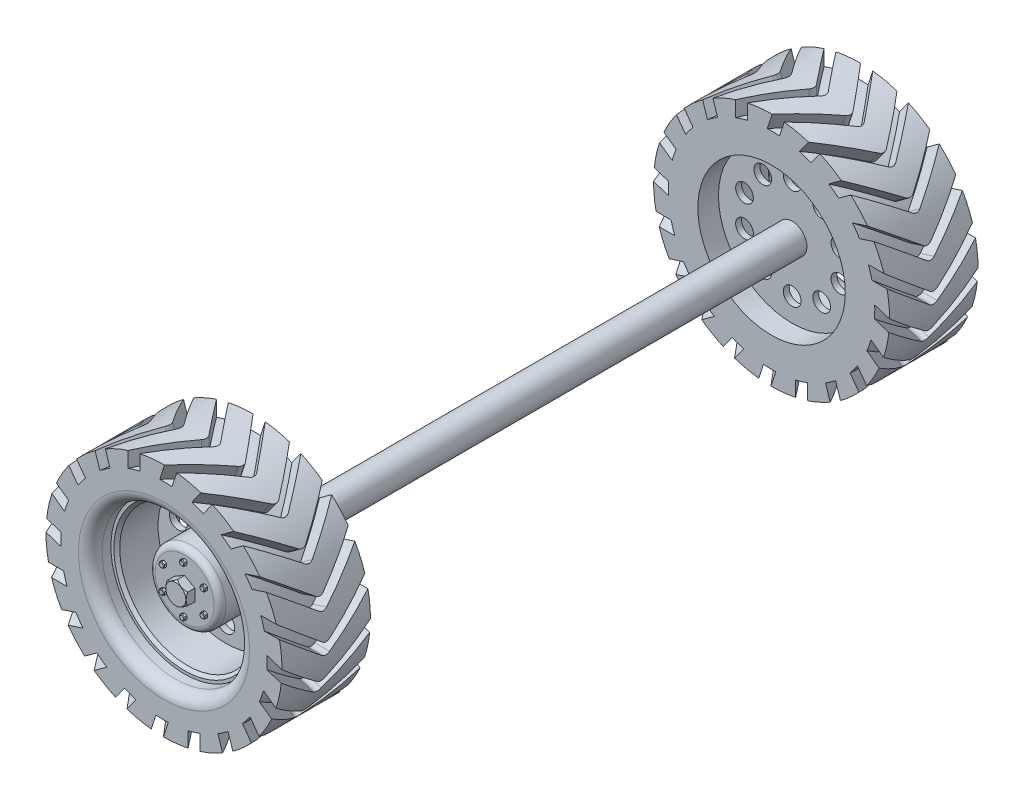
SolidWorks part; units mm, degrees
ref_plane "前基準面" through (0, 0, 0) normal (0, 0, 1) x (1, 0, 0)
ref_plane "上基準面" through (0, 0, 0) normal (0, 1, 0) x (1, 0, 0)
ref_plane "右基準面" through (0, 0, 0) normal (1, 0, 0) x (0, 0, -1)
sketch "草圖1" plane through (0, 0, 0) normal (0, 0, 1) x (1, 0, 0)
  circle A0 centre (0, 0) radius 125
  dimension "D1" = 250
extrude "填料-伸長1" add sketch "草圖1" along normal mid plane 80
shell "薄殼1" thickness 10
sketch "草圖3" plane through (0, 0, 0) normal (0, 0, 1) x (1, 0, 0)
  circle A0 centre (0, 0) radius 200
  circle A1 centre (0, 0) radius 125
  dimension "D1" = 400
  dimension "D2" = 250
extrude "填料-伸長2" add sketch "草圖3" along normal mid plane 150
chamfer "導角1" distance 5 angle 45 1 edges at (115, 0, 40)
fillet "圓角2" radius 20 1 edges at (125, 0, 75)
sketch "草圖4" plane through (0, 0, -30) normal (0, 0, 1) x (1, 0, 0)
  circle A0 centre (0, 0) radius 60
  dimension "D1" = 120
extrude "填料-伸長3" add sketch "草圖4" along normal up to surface (70 mm away)
fillet "圓角4" radius 10 1 edges at (60, 0, 40)
sketch "草圖5" plane through (0, 0, -30) normal (0, 0, 1) x (1, 0, 0)
  line L0 (0, 0) -> (0, 85) construction
  circle A0 centre (0, 85) radius 15
  dimension "D1" = 30
  dimension "D2" = 85
extrude "除料-伸長2" cut sketch "草圖5" against normal blind 100
pattern_circular "環狀複製排列1" count 10 over 360 about axis through (0, 0, 0) along (0, 0, 1) of "除料-伸長2"
fillet "圓角5" radius 5 1 edges at (60, 0, -30)
sketch "草圖7" plane through (0, 0, 40) normal (0, 0, 1) x (1, 0, 0)
  circle A0 centre (0, 0) radius 20
  dimension "D1" = 40
extrude "填料-伸長5" add sketch "草圖7" along normal blind 15
chamfer "導角2" distance 3 angle 45 1 edges at (20, 0, 55)
sketch "草圖8" plane through (0, 0, 55) normal (0, 0, 1) x (1, 0, 0)
  line L1 (0, 20) -> (-17.3205, 10)
  line L2 (-17.3205, 10) -> (-17.3205, -10)
  line L3 (-17.3205, -10) -> (0, -20)
  line L4 (0, -20) -> (17.3205, -10)
  line L5 (17.3205, -10) -> (17.3205, 10)
  line L6 (17.3205, 10) -> (0, 20)
  circle A0 centre (0, 0) radius 17.3205 construction
  circle A1 centre (0, 0) radius 20
extrude "除料-伸長3" cut sketch "草圖8" against normal blind 15 contours L1 A1 | L6 A1 | L2 A1 | L3 A1 | L4 A1 | L5 A1
sketch "草圖9" plane through (0, 0, 40) normal (0, 0, 1) x (1, 0, 0)
  circle A0 centre (0, 0) radius 40 construction
  circle A1 centre (0, 40) radius 5
  dimension "D1" = 80
  dimension "D2" = 10
extrude "填料-伸長6" add sketch "草圖9" along normal blind 5
chamfer "導角3" distance 1.5 angle 45 1 edges at (5, 40, 45)
pattern_circular "環狀複製排列2" count 6 over 360 about axis through (0, 0, 0) along (0, 0, 1) of "填料-伸長6"
chamfer "導角4" distance 1.5 angle 45 5 edges at (37.141, 15.6699, 45) (32.141, -24.3301, 45) (-5, -40, 45) (-37.141, -15.6699, 45) (-32.141, 24.3301, 45)
sketch "草圖10" plane through (0, 0, 45) normal (0, 0, 1) x (1, 0, 0)
  line L1 (0, 45) -> (-4.3301, 42.5)
  line L2 (-4.3301, 42.5) -> (-4.3301, 37.5)
  line L3 (-4.3301, 37.5) -> (0, 35)
  line L4 (0, 35) -> (4.3301, 37.5)
  line L5 (4.3301, 37.5) -> (4.3301, 42.5)
  line L6 (4.3301, 42.5) -> (0, 45)
  circle A0 centre (0, 40) radius 4.3301 construction
  circle A1 centre (0, 40) radius 5
extrude "除料-伸長4" cut sketch "草圖10" against normal blind 5 contours L1 A1 | L6 A1 | L2 A1 | L3 A1 | L4 A1 | L5 A1
pattern_circular "環狀複製排列4" count 6 over 360 about axis through (0, 0, 0) along (0, 0, 1) of "除料-伸長4"
ref_plane "平面1" through (0, 300, 0) normal (0, 1, 0) x (1, 0, 0)
sketch "草圖11" plane through (0, 300, 0) normal (0, 1, 0) x (1, 0, 0)
  line L1 (-5.1172, -6.303) -> (-60.8905, -75)
  line L2 (0, 0) -> (20, 0) construction
  line L8 (-200, -75) -> (200, -75) construction
  line L9 (-5.1172, 6.303) -> (-60.8905, 75)
  line L10 (200, 75) -> (-200, 75) construction
  line L11 (-60.8905, 75) -> (-60.8905, -75) construction
  line L16 (14.8828, -6.303) -> (-40.8905, -75)
  line L17 (14.8828, 6.303) -> (-40.8905, 75)
  line L18 (-60.8905, -75) -> (-40.8905, -75)
  line L19 (-60.8905, 75) -> (-40.8905, 75)
  arc A0 (14.8828, -6.303) -> (14.8828, 6.303) centre (7.1192, 0) ccw
  arc A1 (-5.1172, -6.303) -> (-5.1172, 6.303) centre (-12.8808, 0) ccw
  dimension "D2" = 10
  dimension "D1" = 20
sketch "草圖13" plane through (0, 0, 75) normal (0, 0, 1) x (1, 0, 0)
  circle A0 centre (0, 0) radius 175
  dimension "D1" = 350
surface "曲面-伸長1" sketch "草圖13" parameters "D1"=176
extrude "除料-伸長5" cut sketch "草圖11" against normal up to surface (125.0748 mm away)
pattern_circular "環狀複製排列6" count 20 over 360 about axis through (0, 0, 0) along (0, 0, 1) of "除料-伸長5"
sketch "草圖14" plane through (0, 0, -40) normal (0, 0, -1) x (-1, 0, 0)
  circle A0 centre (0, 0) radius 25
  dimension "D1" = 50
extrude "填料-伸長7" add sketch "草圖14" along normal blind 1000
ref_plane "平面2" through (0, 0, -515) normal (0, 0, -1) x (-1, 0, 0)
mirror "鏡射2" about plane through (0, 0, -515) normal (0, 0, -1) of "環狀複製排列6", "除料-伸長5", "環狀複製排列4", "除料-伸長4", "環狀複製排列2", "填料-伸長6", "除料-伸長3", "填料-伸長5", "環狀複製排列1", "除料-伸長2", "填料-伸長3", "填料-伸長2", "薄殼1", "填料-伸長1"
fillet "圓角7" radius 20 1 edges at (125, 0, -1105)
sketch "草圖15" plane through (0, 0, -1070) normal (0, 0, -1) x (-1, 0, 0)
  circle A0 centre (0, 0) radius 60
  circle A1 centre (0, 0) radius 115
  dimension "D1" = 120
  dimension "D2" = 230
extrude "除料-伸長6" cut sketch "草圖15" against normal up to surface (70 mm away)
chamfer "導角5" distance 5 angle 45 1 edges at (-115, 0, -1070)
fillet "圓角8" radius 10 1 edges at (-60, 0, -1070)
sketch "草圖16" plane through (0, 0, -1070) normal (0, 0, -1) x (-1, 0, 0)
  circle A0 centre (0, 0) radius 20
extrude "填料-伸長8" add sketch "草圖16" along normal up to surface (15 mm away)
sketch "草圖17" plane through (0, 0, -1070) normal (0, 0, -1) x (-1, 0, 0)
  circle A0 centre (0, 40) radius 5
  circle A1 centre (34.641, 20) radius 5
  circle A2 centre (34.641, -20) radius 5
  circle A3 centre (0, -40) radius 5
  circle A4 centre (-34.641, -20) radius 5
  circle A5 centre (-34.641, 20) radius 5
  point P15 (0, 0)
  dimension "D1" = 6
extrude "填料-伸長9" add sketch "草圖17" along normal up to surface (5 mm away)
chamfer "導角6" distance 3 angle 45 1 edges at (-20, 0, -1085)
chamfer "導角7" distance 1.5 angle 45 6 edges at (29.641, -20, -1075) (-5, -40, -1075) (-39.641, -20, -1075) (-39.641, 20, -1075) (29.641, 20, -1075) (-5, 40, -1075)
sketch "草圖19" plane through (0, 0, -1085) normal (0, 0, -1) x (-1, 0, 0)
  line L7 (0, 20) -> (-17.3205, 10)
  line L8 (-17.3205, 10) -> (-17.3205, -10)
  line L9 (-17.3205, -10) -> (0, -20)
  line L10 (0, -20) -> (17.3205, -10)
  line L11 (17.3205, -10) -> (17.3205, 10)
  line L12 (17.3205, 10) -> (0, 20)
  circle A0 centre (0, 0) radius 17.3205 construction
  circle A1 centre (0, 0) radius 20
extrude "除料-伸長7" cut sketch "草圖19" against normal up to surface (15 mm away) contours L12 A1 | L11 A1 | L10 A1 | L9 A1 | L8 A1 | L7 A1
sketch "草圖20" plane through (0, 0, -1075) normal (0, 0, -1) x (-1, 0, 0)
  line L1 (0, 45) -> (-4.3301, 42.5)
  line L2 (-4.3301, 42.5) -> (-4.3301, 37.5)
  line L3 (-4.3301, 37.5) -> (0, 35)
  line L4 (0, 35) -> (4.3301, 37.5)
  line L5 (4.3301, 37.5) -> (4.3301, 42.5)
  line L6 (4.3301, 42.5) -> (0, 45)
  circle A0 centre (0, 40) radius 4.3301 construction
  circle A1 centre (0, 40) radius 5
extrude "除料-伸長8" cut sketch "草圖20" against normal up to surface (5 mm away) contours L6 A1 | L1 A1 | L2 A1 | L3 A1 | L4 A1 | L5 A1
pattern_circular "環狀複製排列7" count 6 over 360 about axis through (0, 0, 0) along (0, 0, 1) of "除料-伸長8"
fillet "圓角9" radius 5 1 edges at (-60, 0, -1000)
